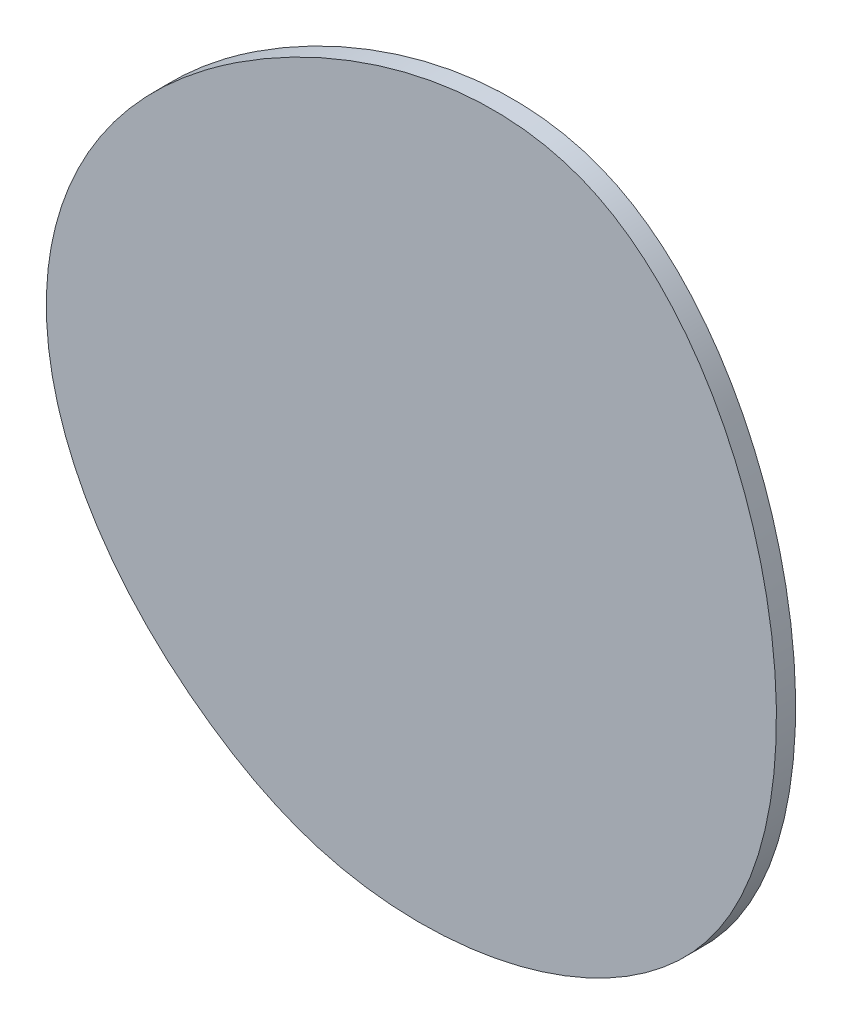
SolidWorks part; units mm, degrees
ref_plane "Plan de face" through (0, 0, 0) normal (0, 0, 1) x (1, 0, 0)
ref_plane "Plan de dessus" through (0, 0, 0) normal (0, 1, 0) x (1, 0, 0)
ref_plane "Plan de droite" through (0, 0, 0) normal (1, 0, 0) x (0, 0, -1)
sketch "Esquisse1" plane through (0, 0, 0) normal (0, 0, 1) x (1, 0, 0)
  line L1 (-5.732, 5.1295) -> (4.268, 5.1295) construction
  line L2 (-5.732, 5.1295) -> (-5.732, -4.8705) construction
  line L3 (-5.732, -4.8705) -> (4.268, -4.8705) construction
  line L4 (4.268, 5.1295) -> (4.268, -4.8705) construction
  spline S0 degree 3 poles (-6.1508, -2.4677) (-6.2692, 3.8598) (5.0821, 8.1454) (7.7955, -4.0675) (0.0147, -6.0122) (-6.1508, -2.4677) (-6.2692, 3.8598) (5.0821, 8.1454) knots -0.573588 -0.397134 -0.339775 0 0.169256 0.426412 0.602866 0.660225 1 1.169256 1.426412 1.602866 only from (-2.8974, 4.4996) to (-2.8974, 4.4996)
  dimension "D1" = 10
  dimension "D2" = 10
extrude "Boss.-Extru.1" add sketch "Esquisse1" along normal blind 0.3
